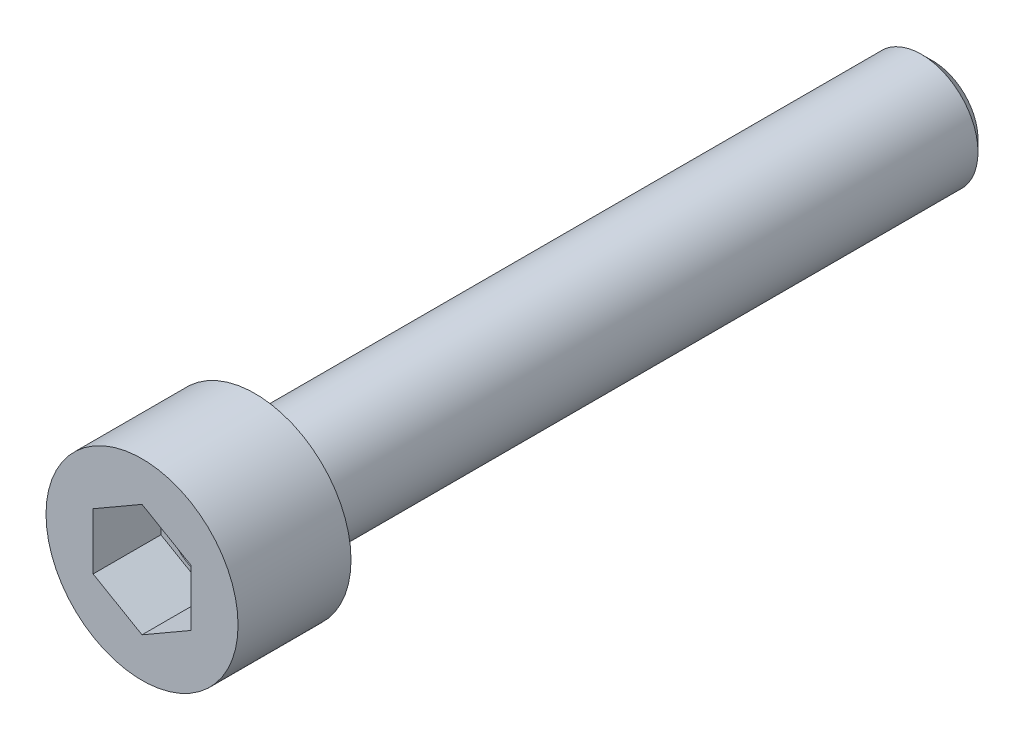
SolidWorks part; units mm, degrees
ref_plane "Face" through (0, 0, 0) normal (0, 0, 1) x (1, 0, 0)
ref_plane "Dessus" through (0, 0, 0) normal (0, 1, 0) x (1, 0, 0)
ref_plane "Droite" through (0, 0, 0) normal (1, 0, 0) x (0, 0, -1)
sketch "Esquisse1" plane through (0, 0, 0) normal (0, 0, 1) x (1, 0, 0)
  circle A0 centre (0, 0) radius 4.25
  dimension "D1" = 8.5
extrude "Extrusion2" add sketch "Esquisse1" against normal blind 5
sketch "Esquisse2" plane through (0, 0, -5) normal (0, 0, -1) x (-1, 0, 0)
  circle A0 centre (0, 0) radius 2.5
  dimension "D1" = 5
extrude "Extrusion3" add sketch "Esquisse2" along normal blind 30
sketch "Esquisse3" plane through (0, 0, 0) normal (0, 0, 1) x (1, 0, 0)
  line L1 (0, -2.5) -> (2.1651, -1.25)
  line L2 (2.1651, -1.25) -> (2.1651, 1.25)
  line L3 (2.1651, 1.25) -> (0, 2.5)
  line L4 (0, 2.5) -> (-2.1651, 1.25)
  line L5 (-2.1651, 1.25) -> (-2.1651, -1.25)
  line L6 (-2.1651, -1.25) -> (0, -2.5)
  circle A0 centre (0, 0) radius 2.1651 construction
  dimension "D1" = 2.5
extrude "Enlèv. mat.-Extru.1" cut sketch "Esquisse3" against normal blind 3
sketch "Esquisse4" plane through (0, 0, -3) normal (0, 0, 1) x (1, 0, 0)
  line L0 (2.1651, 1.25) -> (0, 2.5) construction
  circle A0 centre (0, 0) radius 2.1651
hole_wizard "Trou taraudé 1/16 NPT1" positions "Esquisse3D1" profile "Esquisse5" size "1/16" standard "Ansi Pouce"
sketch3d "Esquisse3D1"
  point P0 (0, 0, 0)
  point P2 (0, 0, -3)
sketch "Esquisse5" plane through (0, 0, -3) normal (1, 0, 0) x (0, -1, 0)
  line L0 (0, 0) -> (0, 1.5624)
  line L1 (2.6, 0.0002) -> (0, 1.5624)
  line L2 (-2.6, 0.0002) -> (0, 1.5624) construction
  line L3 (2.6, 0.0002) -> (2.6, 0.0001)
  line L4 (2.6, 0.0001) -> (2, 0.0001)
  line L5 (2, 0.0001) -> (2, 0)
  line L6 (-2, 0.0001) -> (-2, 0) construction
  line L7 (2, 0) -> (0, 0)
  line L8 (0, -6.35) -> (0, 107.95) construction
  line L11 (-2.6, 0.0001) -> (-2, 0.0001) construction
  dimension "Diamètre du trou pour taraudage" = 5.2
  dimension "Profondeur du trou pour taraudage" = 0.0002
  dimension "Diamètre du filetage" = 4
  dimension "Angle de filetage" = 3.43
  dimension "Profondeur du filetage" = 0.0001
  dimension "Angle de pointe" = 118
chamfer "Chanfrein1" distance 0.5 angle 45
